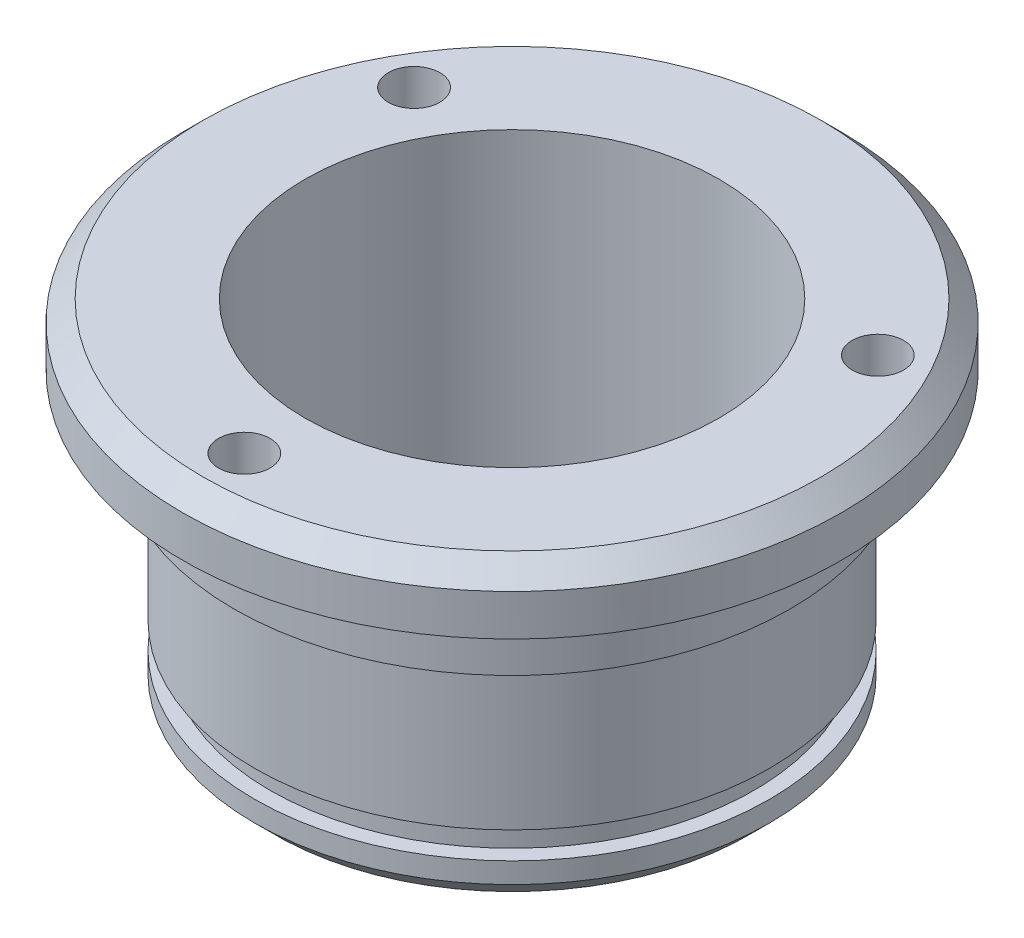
SolidWorks part; units mm, degrees
ref_plane "前视基准面" through (0, 0, 0) normal (0, 0, 1) x (1, 0, 0)
ref_plane "上视基准面" through (0, 0, 0) normal (0, 1, 0) x (1, 0, 0)
ref_plane "右视基准面" through (0, 0, 0) normal (1, 0, 0) x (0, 0, -1)
sketch "草图1" plane through (0, 0, 0) normal (0, 0, 1) x (1, 0, 0)
  line L0 (0, 0) -> (0, 17.0132) construction
  line L1 (12.5, 0) -> (10.05, 0)
  line L2 (12.5, 0) -> (12.5, 2)
  line L3 (12.5, 2) -> (11.75, 2)
  line L4 (11.75, 2) -> (11.75, 3.3)
  line L5 (11.75, 3.3) -> (12.5, 3.3)
  line L6 (12.5, 3.3) -> (12.5, 10.5)
  line L7 (12.5, 10.5) -> (13.5, 10.5)
  line L8 (16, 13.8) -> (16, 16.8)
  line L9 (16, 16.8) -> (10.05, 16.8)
  line L10 (10.05, 0) -> (10.05, 16.8)
  line L11 (13.5, 10.5) -> (13.5, 13.8)
  line L12 (13.5, 13.8) -> (16, 13.8)
  point P12 (12.5, 6.9)
  dimension "D1" = 7.2
  dimension "D2" = 23.5
  dimension "D3" = 25
  dimension "D4" = 1.3
  dimension "D5" = 20.1
  dimension "D6" = 2
  dimension "D7" = 27
  dimension "D8" = 10.5
  dimension "D9" = 32
  dimension "D10" = 3
revolve "旋转1" add sketch "草图1" angle 360 about L0
chamfer "倒角1" distance 1 angle 45 1 edges at (0, 0, -12.5)
chamfer "倒角2" distance 1 angle 45 1 edges at (0, 16.8, -16)
sketch "草图2" plane through (0, 13.8, 0) normal (0, -1, 0) x (-1, 0, 0)
  line L1 (-11.2583, 6.5) -> (0, -13) construction
  line L2 (0, -13) -> (11.2583, 6.5) construction
  line L3 (11.2583, 6.5) -> (-11.2583, 6.5) construction
  circle A0 centre (0, 0) radius 13
  circle A3 centre (0, 0) radius 6.5 construction
  circle A4 centre (-11.2583, 6.5) radius 1.45 construction
  circle A5 centre (11.2583, 6.5) radius 1.45 construction
  circle A6 centre (0, -13) radius 1.45 construction
  dimension "D1" = 26
  dimension "D2" = 2.9
sketch "草图3" plane through (0, 16.8, 0) normal (0, 1, 0) x (1, 0, 0)
  point P0 (-11.2583, 6.5)
  point P1 (11.2583, 6.5)
  point P3 (0, -13)
hole_wizard "M3 螺纹孔2" positions "3D草图2" profile "草图5" tap size "M3" standard "GB"
sketch3d "3D草图2"
  point P0 (11.2583, 16.8, -6.5)
  point P3 (-11.2583, 16.8, -6.5)
  point P6 (0, 16.8, 13)
sketch "草图5" plane through (11.2583, 16.8, -6.5) normal (1, 0, 0) x (0, 0, 1)
  line L0 (0, 0) -> (0, 4.7511)
  line L1 (0, 4.7511) -> (1.25, 4)
  line L2 (1.25, 4) -> (1.25, 0)
  line L5 (1.25, 0) -> (0, 0)
  line L10 (0, 4.7511) -> (-1.25, 4) construction
  line L11 (0, -6.35) -> (0, 107.95) construction
  dimension "螺纹孔钻头直径" = 2.5
  dimension "螺纹孔钻头深度" = 4
  dimension "导头角度" = 118
fillet "圆角1" radius 0.2 4 edges at (11.6913, 13.8, 6.75) (0, 10.5, -12.5) (-11.6913, 13.8, 6.75) (0, 13.8, -13.5)
